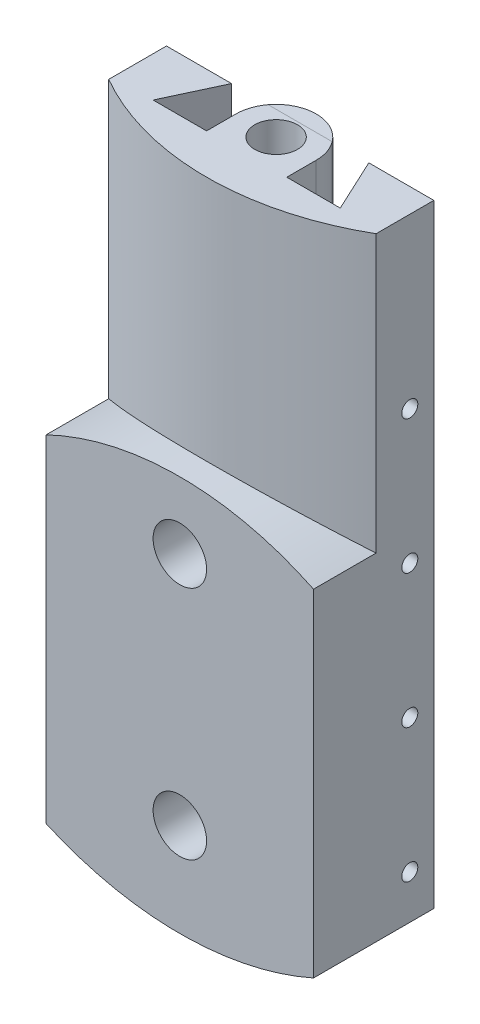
SolidWorks part; units mm, degrees
ref_plane "Front Plane" through (0, 0, 0) normal (0, 0, 1) x (1, 0, 0)
ref_plane "Top Plane" through (0, 0, 0) normal (0, 1, 0) x (1, 0, 0)
ref_plane "Right Plane" through (0, 0, 0) normal (1, 0, 0) x (0, 0, -1)
sketch "Sketch1" plane through (0, 0, 0) normal (0, 0, 1) x (1, 0, 0)
  line L1 (50, -120) -> (-50, -120)
  line L2 (50, -120) -> (50, 120)
  line L3 (50, 120) -> (-50, 120)
  line L4 (-50, -120) -> (-50, 120)
  line L5 (50, -120) -> (-50, 120) construction
  line L6 (50, 120) -> (-50, -120) construction
  point P0 (0, 0)
  dimension "D1" = 100
  dimension "D2" = 240
extrude "Boss-Extrude1" add sketch "Sketch1" along normal blind 45
sketch "Sketch2" plane through (0, 120, 0) normal (0, 1, 0) x (1, 0, 0)
  line L0 (-50, -45) -> (-50, 0) construction
  line L1 (50, -45) -> (50, 0) construction
  line L2 (50, -45) -> (-50, -45) construction
  arc A0 (-50, -21.6025) -> (50, -21.6025) centre (0, 65) ccw
  point P3 (0, -35)
  point P9 (0, 0)
  dimension "D1" = 100
  dimension "D2" = 110
extrude "Cut-Extrude1" cut sketch "Sketch2" against normal blind 92 and the other way through all flip side to cut
sketch "Sketch3" plane through (0, 120, 0) normal (0, 1, 0) x (1, 0, 0)
  line L0 (-15, -9) -> (-15, -20)
  line L1 (15, -9) -> (15, -20)
  line L2 (15, -20) -> (35, -20)
  line L3 (35, -20) -> (25.6738, 0)
  line L4 (50, 0) -> (-50, 0) construction
  line L5 (-15, -20) -> (-35, -20)
  line L6 (-35, -20) -> (-25.6738, 0)
  line L7 (-25.6738, 0) -> (-50, 0)
  line L8 (-50, 0) -> (-50, -45)
  line L9 (-50, -45) -> (50, -45)
  line L10 (50, -45) -> (50, 0)
  line L11 (50, 0) -> (25.6738, 0)
  arc A0 (15, -9) -> (-15, -9) centre (0, -9) ccw
  circle A1 centre (0, -9) radius 8
  point P7 (0, 6)
  dimension "D1" = 30
  dimension "D7" = 9
  dimension "D8" = 16
  dimension "D2" = 20
  dimension "D3" = 65
  dimension "D4" = 65
  dimension "D5" = 70
  dimension "D6" = 35
extrude "Cut-Extrude2" cut sketch "Sketch3" against normal through all
sketch "Sketch4" plane through (0, 120, 0) normal (0, 1, 0) x (1, 0, 0)
  line L0 (-11.9999, 0.0002) -> (11.9999, 0.0002)
  arc A0 (11.9999, 0.0002) -> (-11.9999, 0.0002) centre (0, -9) ccw
  dimension "D1" = 30
extrude "Boss-Extrude2" add sketch "Sketch4" against normal blind 25 separate body
sketch "Sketch5" plane through (50, 0, 0) normal (1, 0, 0) x (0, 0, -1)
  line L0 (-21.6025, 120) -> (0, 120) construction
  line L1 (6, 95) -> (6, 120) construction
  circle A0 centre (-9, 57) radius 3
  circle A1 centre (-9, 7) radius 3
  circle A2 centre (-9, -43) radius 3
  circle A3 centre (-9, -93) radius 3
  dimension "D1" = 6
  dimension "D2" = 63
  dimension "D3" = 15
  dimension "D4" = 4
extrude "Cut-Extrude3" cut sketch "Sketch5" against normal blind 28
mirror "Mirror1" about plane through (0, 0, 0) normal (1, 0, 0) of "Cut-Extrude3"
sketch "Sketch6" plane through (0, 0, 45) normal (0, 0, 1) x (1, 0, 0)
  line L0 (-50, 28) -> (-50, -120) construction
  line L1 (50, -120) -> (50, 28) construction
  line L2 (-50, -120) -> (50, -120) construction
  arc A0 (-50, -109.3788) -> (50, -109.3788) centre (0, 3) ccw
  point P3 (0, -120)
  point P11 (0, 0)
  dimension "D1" = 123
extrude "Cut-Extrude4" cut sketch "Sketch6" against normal through all and the other way through all flip side to cut
sketch "Sketch7" plane through (0, 0, 45) normal (0, 0, 1) x (1, 0, 0)
  circle A0 centre (0, -85) radius 10
  circle A1 centre (0, 3) radius 10
  arc A2 (-50, -109.3788) -> (50, -109.3788) centre (0, 3) ccw construction
  point P6 (0, 0)
  point P9 (0, -120)
  dimension "D1" = 20
  dimension "D2" = 20
  dimension "D3" = 88
  dimension "D4" = 35
extrude "Cut-Extrude5" cut sketch "Sketch7" against normal blind 23
sketch "Sketch8" plane through (0, 0, 45) normal (0, 0, 1) x (1, 0, 0)
  line L0 (-50, 28) -> (-50, -109.3788) construction
  line L1 (50, -109.3788) -> (50, 28) construction
  line L2 (50, 28) -> (-50, 28) construction
  line L3 (-50, 16.5616) -> (-50, 28)
  line L4 (-50, 28) -> (50, 28)
  line L5 (50, 28) -> (50, 16.5616)
  arc A0 (-50, 16.5616) -> (50, 16.5616) centre (0, -87) cw
  point P3 (0, 28)
  dimension "D1" = 115
extrude "Cut-Extrude9" cut sketch "Sketch8" against normal up to surface (10 mm away) contours A0 L4 M6 | A0 M5 M4
